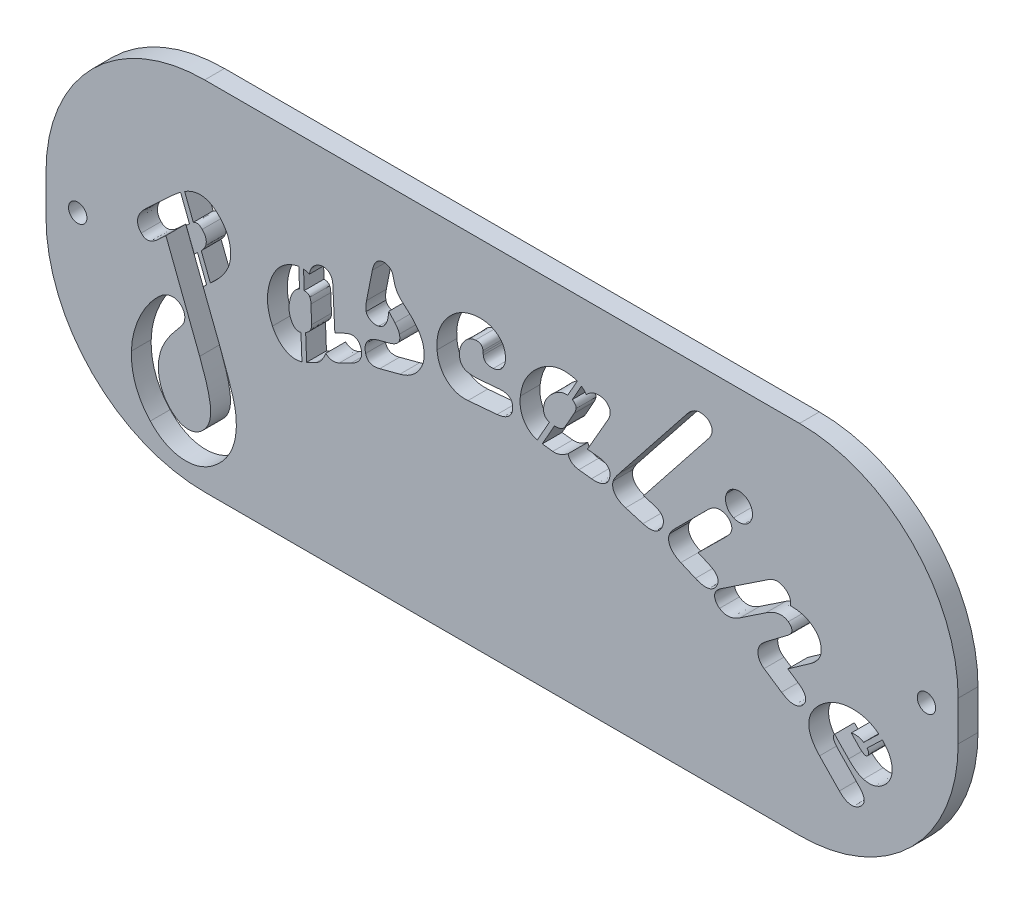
SolidWorks part; units mm, degrees
ref_plane "Front Plane" through (0, 0, 0) normal (0, 0, 1) x (1, 0, 0)
ref_plane "Top Plane" through (0, 0, 0) normal (0, 1, 0) x (1, 0, 0)
ref_plane "Right Plane" through (0, 0, 0) normal (1, 0, 0) x (0, 0, -1)
sketch "Sketch1" plane through (0, 0, 0) normal (0, 0, 1) x (1, 0, 0)
  line L1 (0, 0) -> (146.05, 0)
  line L2 (0, 0) -> (0, 57.15)
  line L3 (0, 57.15) -> (146.05, 57.15)
  line L4 (146.05, 0) -> (146.05, 57.15)
  dimension "D1" = 146.05
  dimension "D2" = 57.15
extrude "Boss-Extrude1" add sketch "Sketch1" along normal blind 3.175
hole_wizard "#4 Clearance Hole1" positions "Sketch3" profile "Sketch2" hole size "#4" standard "ANSI Inch"
sketch "Sketch3" plane through (-66.675, -37.1923, 3.175) normal (0, 0, 1) x (1, 0, 0)
  line L3 (66.675, 94.3423) -> (66.675, 37.1923) construction
  point P17 (71.755, 65.7673)
  point P19 (207.645, 65.7673)
  point P29 (66.675, 65.7673)
  dimension "D1" = 135.89
  dimension "D2" = 5.08
sketch "Sketch2" plane through (5.08, 28.575, 3.175) normal (1, 0, 0) x (0, -1, 0)
  line L0 (0, 0) -> (0, 3.302)
  line L1 (0, 3.302) -> (1.4732, 3.302)
  line L2 (1.4732, 3.302) -> (1.4732, 0)
  line L5 (1.4732, 0) -> (0, 0)
  line L10 (0, 3.302) -> (-1.4732, 3.302) construction
  line L11 (0, -6.35) -> (0, 107.95) construction
  dimension "Hole Dia." = 2.9464
  dimension "Hole Depth" = 3.302
  dimension "Drill Angle" = 180
sketch "Sketch4" plane through (0, 0, 3.175) normal (0, 0, 1) x (1, 0, 0)
  line L0 (0, 0) -> (146.05, 0) construction
  arc A0 (17.1955, 5.5729) -> (130.1934, 5.5729) centre (73.6944, -35.56) cw construction
  text T0 "Pascaline" font "Harlow Solid Italic" height in points 72
  dimension "D1" = 35.56
extrude "Cut-Extrude3" cut sketch "Sketch4" against normal through all
sketch "Sketch5" plane through (0, 0, 0) normal (0, 0, 1) x (1, 0, 0)
  line L0 (20.7492, 41.713) -> (26.3737, 27.1762)
  line L1 (22.4491, 35.4971) -> (23.7423, 32.1548) construction
  line L2 (21.4599, 41.988) -> (27.0844, 27.4511)
  line L3 (20.7492, 41.713) -> (21.4599, 41.988)
  line L4 (27.0844, 27.4511) -> (26.3737, 27.1762)
  line L5 (41.1627, 40.6656) -> (41.8246, 23.6857)
  line L6 (130.9028, 16.9817) -> (130.3733, 17.5296)
  line L9 (42.5302, 31.7748) -> (42.4209, 34.5799) construction
  line L10 (40.4013, 40.6359) -> (41.0632, 23.656)
  line L11 (40.4013, 40.6359) -> (41.1627, 40.6656)
  line L12 (41.0632, 23.656) -> (41.8246, 23.6857)
  line L13 (86.6975, 46.5649) -> (78.6825, 32.3343)
  line L14 (83.1608, 38.0102) -> (84.5586, 40.492) construction
  line L15 (86.0335, 46.9388) -> (78.0186, 32.7082)
  line L16 (86.0335, 46.9388) -> (86.6975, 46.5649)
  line L17 (78.6825, 32.3343) -> (78.0186, 32.7082)
  line L18 (134.052, 21.0848) -> (130.3733, 17.5296)
  line L19 (128.9289, 18.3649) -> (130.1603, 17.0907) construction
  line L20 (134.5815, 20.5368) -> (130.9028, 16.9817)
  line L21 (134.052, 21.0848) -> (134.5815, 20.5368)
  dimension "D1" = 0.762
  dimension "D2" = 0.762
  dimension "D3" = 0.762
  dimension "D4" = 0.762
extrude "Boss-Extrude2" add sketch "Sketch5" along normal blind 3.175
fillet "Fillet1" radius 25.4 4 edges at (146.05, 0, 1.5875) (0, 0, 1.5875) (146.05, 57.15, 1.5875) (0, 57.15, 1.5875)
